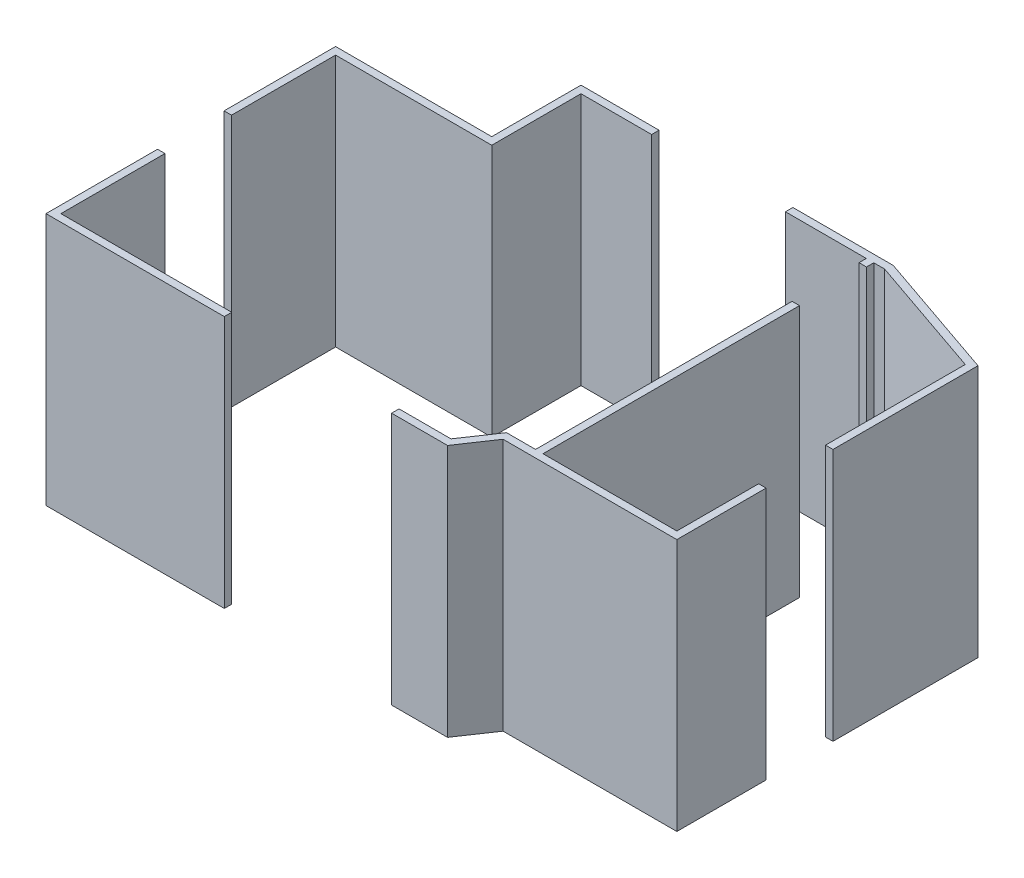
SolidWorks part; units mm, degrees
ref_plane "Front Plane" through (0, 0, 0) normal (0, 0, 1) x (1, 0, 0)
ref_plane "Top Plane" through (0, 0, 0) normal (0, 1, 0) x (1, 0, 0)
ref_plane "Right Plane" through (0, 0, 0) normal (1, 0, 0) x (0, 0, -1)
body saved out of another part "Stock-1300-C0001 AO ENCLOSURE-1"
sketch "Sketch1" plane through (0, 0, 0) normal (-1, 0, -0.0002) x (-0.0002, 0, 1)
  line L0 (-3956.1407, 3098.8) -> (0, 3098.8) construction
  line L1 (219.7339, 2997.2) -> (-5267.2231, 2997.2)
  line L2 (219.7339, 2997.2) -> (219.7339, 3166.1878)
  line L3 (219.7339, 3166.1878) -> (-5267.2231, 3166.1878)
  line L4 (-5267.2231, 2997.2) -> (-5267.2231, 3166.1878)
  line L5 (-5175.7109, 3098.8) -> (-5175.7109, 0) construction
  line L6 (0, 2997.2) -> (0, 0) construction
  dimension "D1" = 101.6
  dimension "D2" = 67.3878
  dimension "D3" = 91.5121
  dimension "D4" = 219.7339
extrude "Cut-Extrude1" cut sketch "Sketch1" against normal through all
sketch "Sketch2" plane through (0, 0, 0) normal (0, 1, 0) x (1, 0, 0)
  line L0 (0, 0) -> (2435.961, 0)
  line L1 (2435.961, 0) -> (2435.961, 101.6)
  line L2 (2435.961, 101.6) -> (101.6, 101.6)
  line L3 (101.6, 101.6) -> (101.6, 1524)
  line L4 (101.6, 1524) -> (0, 1524)
  line L5 (0, 1524) -> (0, 0)
  line L6 (0.6866, 2432.1406) -> (102.2866, 2432.1406)
  line L7 (102.2866, 2432.1406) -> (102.2866, 3854.5406)
  line L8 (102.2866, 3854.5406) -> (2235.8866, 3854.5406)
  line L9 (2235.8866, 3854.5406) -> (2235.8866, 5073.7406)
  line L10 (2235.8866, 5073.7406) -> (3201.0866, 5073.7406)
  line L11 (3201.0866, 5073.7406) -> (3201.0866, 5175.3406)
  line L12 (3201.0866, 5175.3406) -> (2134.2866, 5175.3406)
  line L13 (2134.2866, 5175.3406) -> (2134.2866, 3956.1406)
  line L14 (2134.2866, 3956.1406) -> (0.6866, 3956.1406)
  line L15 (0.6866, 3956.1406) -> (0.6866, 2432.1406)
  line L16 (4721.961, 0) -> (5486.4, 0)
  line L17 (5486.4, 0) -> (5791.7752, 452.7374)
  line L18 (5791.7752, 452.7374) -> (8166.6752, 452.7374)
  line L19 (8166.6752, 452.7374) -> (8166.6752, 1671.9374)
  line L20 (8166.6752, 1671.9374) -> (8065.0752, 1671.9374)
  line L21 (8065.0752, 1671.9374) -> (8065.0752, 554.3374)
  line L22 (8065.0752, 554.3374) -> (6236.2752, 554.3374)
  line L23 (6236.2752, 554.3374) -> (6236.2752, 4059.5374)
  line L24 (6236.2752, 4059.5374) -> (6134.6752, 4059.5374)
  line L25 (6134.6752, 4059.5374) -> (6134.6752, 554.3374)
  line L26 (6134.6752, 554.3374) -> (5737.7536, 554.3374)
  line L27 (5737.7536, 554.3374) -> (5432.3783, 101.6)
  line L28 (5432.3783, 101.6) -> (4721.961, 101.6)
  line L29 (4721.961, 101.6) -> (4721.961, 0)
  line L30 (5029.8866, 5073.7406) -> (6134.6752, 5073.7406)
  line L31 (6134.6752, 5073.7406) -> (6134.6752, 4973.9374)
  line L32 (6134.6752, 4973.9374) -> (6236.2752, 4973.9374)
  line L33 (6236.2752, 4973.9374) -> (6236.2752, 5073.7406)
  line L34 (6236.2752, 5073.7406) -> (6384.4846, 5073.7406)
  line L35 (6384.4846, 5073.7406) -> (8065.0752, 4495.0668)
  line L36 (8065.0752, 4495.0668) -> (8065.0752, 2586.3374)
  line L37 (8065.0752, 2586.3374) -> (8166.6752, 2586.3374)
  line L38 (8166.6752, 2586.3374) -> (8166.6752, 4567.5374)
  line L39 (8166.6752, 4567.5374) -> (6401.4866, 5175.3406)
  line L40 (6401.4866, 5175.3406) -> (5029.8866, 5175.3406)
  line L41 (5029.8866, 5175.3406) -> (5029.8866, 5073.7406)
extrude "Boss-Extrude1" add sketch "Sketch2" against normal blind 457.2
